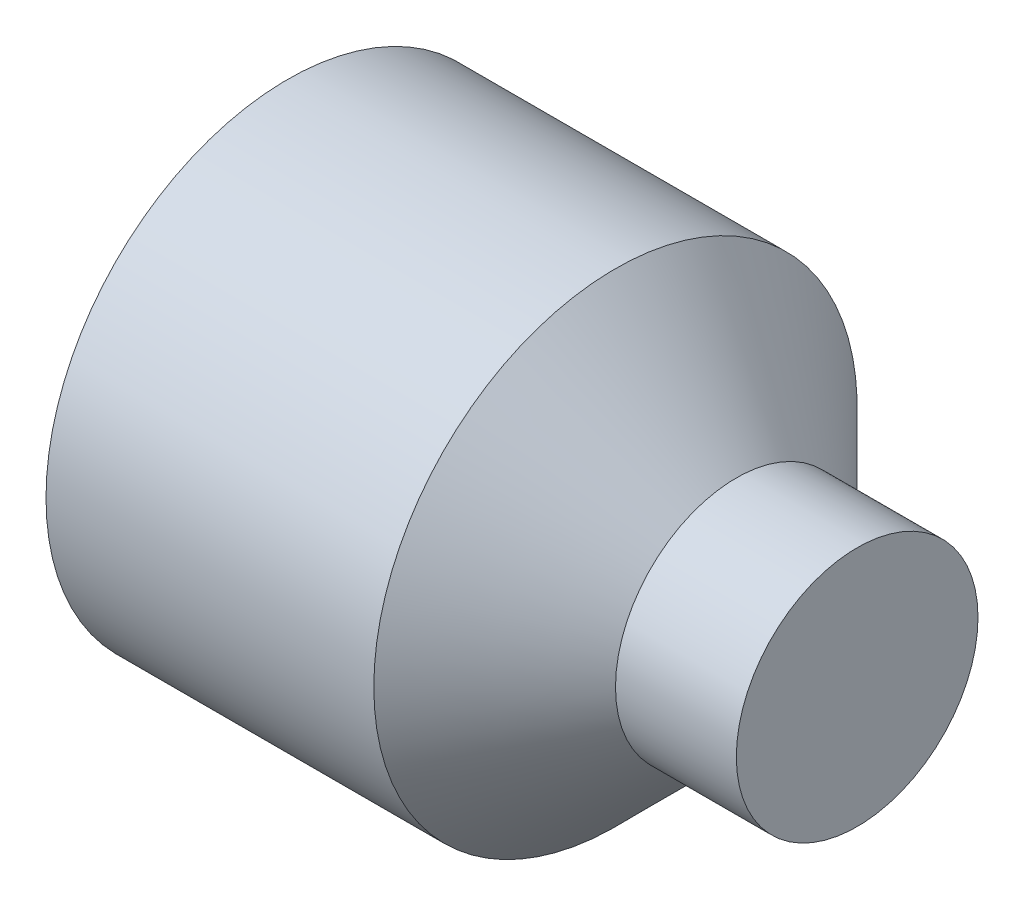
SolidWorks part; units mm, degrees
ref_plane "Front Plane" through (0, 0, 0) normal (0, 0, 1) x (1, 0, 0)
ref_plane "Top Plane" through (0, 0, 0) normal (0, 1, 0) x (1, 0, 0)
ref_plane "Right Plane" through (0, 0, 0) normal (1, 0, 0) x (0, 0, -1)
sketch "BodySke" plane through (0, 0, 0) normal (0, 0, 1) x (1, 0, 0)
  line L0 (0, 0) -> (3.28, 0) construction
  line L1 (2, 0) -> (2, 0.4)
  line L2 (1.2, 0.8) -> (1.6, 0.4)
  line L3 (1.2, 0.8) -> (0, 0.8)
  line L4 (0, 0.8) -> (0, 0)
  line L5 (0, 0) -> (2, 0)
  line L6 (1.65, 1.0236) -> (1.65, -0.6432) construction
  line L7 (1.6, 0.4) -> (2, 0.4)
  point P5 (0, 0.601)
  dimension "D1" = 135
  dimension "Diameter" = 1.6
  dimension "Length" = 2
  dimension "Chamfer_End" = 0.8
  dimension "Minor_dia" = 1.202
  dimension "Advance" = 0.35
  dimension "Length_Dog" = 0.4
revolve "BaseBody" add sketch "BodySke" angle 360 about L0
sketch "HeadChamferSke" plane through (0, 0, 0) normal (0, 0, 1) x (1, 0, 0)
  line L0 (0, 0) -> (2.4505, 0) construction
  line L1 (0, 0.8) -> (0, 0.601)
  line L2 (0, 0.8) -> (0.1149, 0.8)
  line L3 (0.1149, 0.8) -> (0, 0.601)
  line L5 (0, 0.8) -> (0, -0.8) construction
  line L6 (0, 0.8) -> (0, 0) construction
  line L7 (1.2, 0.8) -> (0, 0.8) construction
  dimension "Angle" = 30
revolve "HeadChamfer" cut sketch "HeadChamferSke" angle 360 about L0
sketch "HexagonSocketSke" plane through (0, 0, 0) normal (-1, 0, 0) x (0, 0, 1)
  line L1 (0, 0.4041) -> (-0.35, 0.2021)
  line L2 (-0.35, 0.2021) -> (-0.35, -0.2021)
  line L3 (-0.35, -0.2021) -> (0, -0.4041)
  line L4 (0, -0.4041) -> (0.35, -0.2021)
  line L5 (0.35, -0.2021) -> (0.35, 0.2021)
  line L6 (0.35, 0.2021) -> (0, 0.4041)
  circle A0 centre (0, 0) radius 0.35 construction
  dimension "Hexagon_Width" = 0.7
extrude "HexagonSocket" cut sketch "HexagonSocketSke" against normal blind 0.7
sketch "ThdSchSke" plane through (0, 0, 0) normal (0, 0, 1) x (1, 0, 0)
  line L0 (0, 0) -> (2.6881, 0) construction
  line L1 (0.2351, 1.0298) -> (0.2351, 0.8)
  line L2 (0.2351, 1.0298) -> (0.4649, 1.0298)
  line L3 (0.4649, 1.0298) -> (0.4649, 0.8)
  line L4 (0.4649, 0.8) -> (0.35, 0.601)
  line L5 (0.35, 0.601) -> (0.2351, 0.8)
  line L8 (1.2, 0.8) -> (0.1149, 0.8) construction
  dimension "D1" = 0.35
revolve "ThreadSchematic" [suppressed] cut sketch "ThdSchSke" angle 360 about L0
pattern_linear "ThdSchPat" [suppressed] count 3 along (1, 0, 0)
equation "\"Minor_dia@ThreadCosmetic\" = \"Minor_dia@BodySke\""
equation "\"D1@ThdSchSke\" = \"Advance@BodySke\""
equation "\"Advance@ThdSchPat\" = \"Advance@BodySke\""
equation "\"D1@ThdSchPat\" =  int( ( \"Length@BodySke\" - \"Length_Dog@BodySke\" -  ( \"Diameter@BodySke\" / 2 - \"Chamfer_End@BodySke\" / 2 )  )  / \"Advance@BodySke\") "
